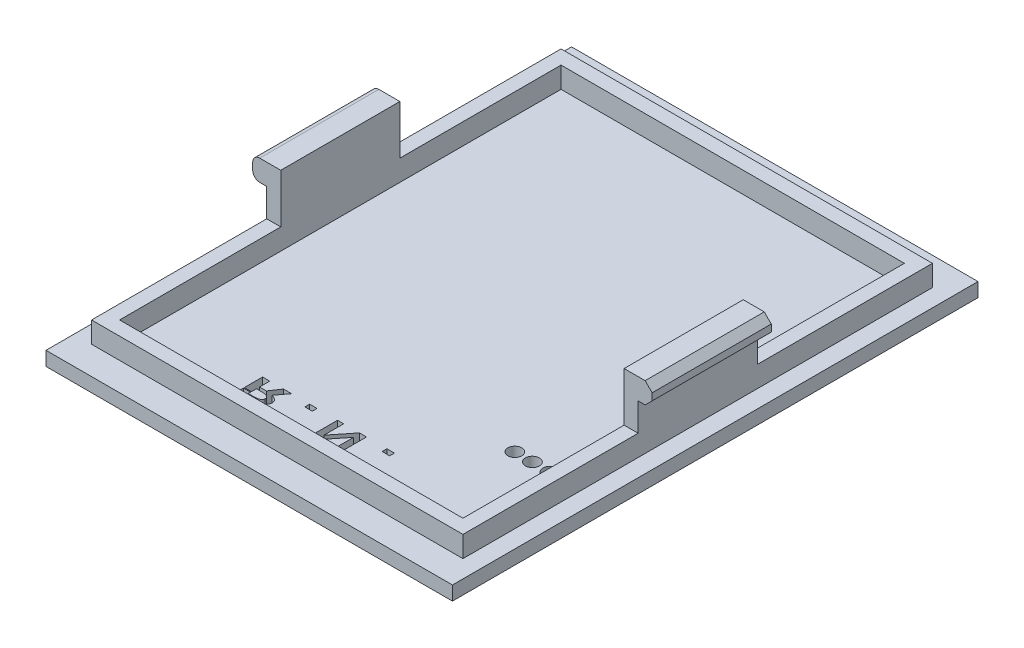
SolidWorks part; units mm, degrees
ref_plane "Plan de face" through (0, 0, 0) normal (0, 0, 1) x (1, 0, 0)
ref_plane "Plan de dessus" through (0, 0, 0) normal (0, 1, 0) x (1, 0, 0)
ref_plane "Plan de droite" through (0, 0, 0) normal (1, 0, 0) x (0, 0, -1)
sketch "Esquisse1" plane through (0, 0, 0) normal (0, 1, 0) x (1, 0, 0)
  line L1 (0, 0) -> (58, 0)
  line L2 (0, 0) -> (0, 75)
  line L3 (0, 75) -> (58, 75)
  line L4 (58, 0) -> (58, 75)
  dimension "D1" = 58
  dimension "D2" = 75
extrude "Boss.-Extru.1" add sketch "Esquisse1" along normal blind 2
sketch "Esquisse4" plane through (0, 2, 0) normal (0, 1, 0) x (1, 0, 0)
  line L0 (0, 75) -> (0, 0) construction
  line L1 (2.5, 4) -> (55.5, 4)
  line L2 (2.5, 4) -> (2.5, 71)
  line L3 (2.5, 71) -> (55.5, 71)
  line L4 (55.5, 4) -> (55.5, 71)
  line L5 (58, 75) -> (0, 75) construction
  line L6 (58, 0) -> (58, 75) construction
  line L7 (0, 0) -> (58, 0) construction
  dimension "D1" = 2.5
  dimension "D2" = 4
  dimension "D3" = 2.5
  dimension "D4" = 4
extrude "Boss.-Extru.3" add sketch "Esquisse4" along normal blind 3
sketch "Esquisse5" plane through (0, 5, 0) normal (0, 1, 0) x (1, 0, 0)
  line L0 (2.5, 71) -> (2.5, 4) construction
  line L1 (4.5, 6) -> (53.5, 6)
  line L2 (4.5, 6) -> (4.5, 69)
  line L3 (4.5, 69) -> (53.5, 69)
  line L4 (53.5, 6) -> (53.5, 69)
  line L5 (55.5, 71) -> (2.5, 71) construction
  line L6 (55.5, 4) -> (55.5, 71) construction
  line L7 (2.5, 4) -> (55.5, 4) construction
  dimension "D1" = 2
  dimension "D2" = 2
  dimension "D3" = 2
  dimension "D4" = 2
extrude "Enlèv. mat.-Extru.1" cut sketch "Esquisse5" against normal blind 3
sketch "Esquisse6" plane through (0, 5, 0) normal (0, 1, 0) x (1, 0, 0)
  line L0 (3.1928, 4) -> (3.1928, 33) construction
  line L1 (2.5, 4) -> (55.5, 4) construction
  line L2 (3.1928, 71) -> (3.1928, 42) construction
  line L3 (55.5, 71) -> (2.5, 71) construction
  line L4 (54.3067, 71) -> (54.3067, 42) construction
  line L5 (54.3067, 4) -> (54.3067, 33) construction
  line L6 (55.5, 4) -> (55.5, 71) construction
  line L7 (55.5, 29) -> (53.5, 29)
  line L8 (55.5, 29) -> (55.5, 46)
  line L9 (55.5, 46) -> (53.5, 46)
  line L10 (53.5, 29) -> (53.5, 46)
  line L11 (53.5, 6) -> (53.5, 69) construction
  line L12 (4.5, 69) -> (4.5, 6) construction
  line L13 (4.5, 29) -> (2.5, 29)
  line L14 (4.5, 29) -> (4.5, 46)
  line L15 (4.5, 46) -> (2.5, 46)
  line L16 (2.5, 29) -> (2.5, 46)
  line L17 (2.5, 71) -> (2.5, 4) construction
  dimension "D1" = 29
  dimension "D2" = 29
  dimension "D3" = 29
  dimension "D4" = 29
extrude "Boss.-Extru.4" add sketch "Esquisse6" along normal blind 7
sketch "Esquisse7" plane through (2.5, 0, 0) normal (-1, 0, 0) x (0, 0, 1)
  line L0 (-46, 12) -> (-46, 5) construction
  line L1 (-29, 12) -> (-46, 12)
  line L2 (-29, 12) -> (-29, 9)
  line L3 (-29, 9) -> (-46, 9)
  line L4 (-46, 12) -> (-46, 9)
  dimension "D1" = 3
extrude "Boss.-Extru.5" add sketch "Esquisse7" along normal blind 2
sketch "Esquisse9" plane through (55.5, 0, 0) normal (1, 0, 0) x (0, 0, -1)
  line L0 (29, 12) -> (29, 5) construction
  line L1 (46, 12) -> (29, 12)
  line L2 (46, 12) -> (46, 9)
  line L3 (46, 9) -> (29, 9)
  line L4 (29, 12) -> (29, 9)
  dimension "D1" = 3
extrude "Boss.-Extru.6" add sketch "Esquisse9" along normal blind 2
chamfer "Chanfrein1" distance 1 angle 45 2 edges at (57.5, 12, -37.5) (57.5, 9, -37.5)
fillet "Congé1" radius 1 2 edges at (0.5, 9, -37.5) (0.5, 12, -37.5)
sketch "Esquisse13" plane through (0, 0, 0) normal (0, -1, 0) x (1, 0, 0)
  text T0 "R . N ." font "Franklin Gothic Medium Cond" height 3.5
extrude "Enlèv. mat.-Extru.3" cut sketch "Esquisse13" against normal blind 2
sketch "Esquisse14" plane through (0, 0, 0) normal (0, -1, 0) x (-1, 0, 0)
  line L1 (-18.6655, 9.4173) -> (-19.8962, 9.4173)
  line L2 (-18.6655, 9.4173) -> (-18.6655, 9.541)
  line L3 (-18.6655, 9.541) -> (-19.8962, 9.541)
  line L4 (-19.8962, 9.4173) -> (-19.8962, 9.541)
extrude "Boss.-Extru.7" add sketch "Esquisse14" against normal blind 2
sketch "Esquisse15" plane through (0, 2, 0) normal (0, 1, 0) x (1, 0, 0)
  line L0 (53.5, 6) -> (53.5, 69) construction
  circle A0 centre (51, 20.9085) radius 1
  circle A1 centre (48.5, 20.9085) radius 1
  circle A2 centre (46, 20.9085) radius 0.992
  dimension "D1" = 2.5
  dimension "D2" = 2.5
  dimension "D3" = 2.5
extrude "Enlèv. mat.-Extru.4" cut sketch "Esquisse15" against normal blind 10
